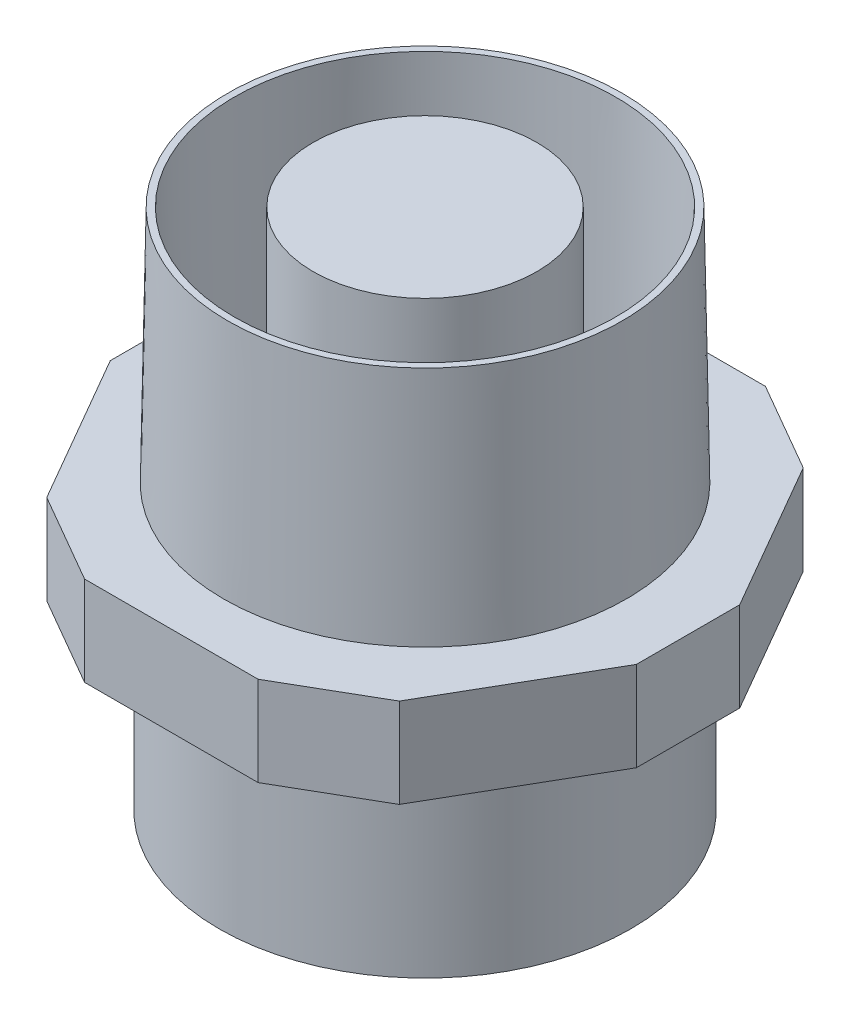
SolidWorks part; units mm, degrees
ref_plane "Plan de face" through (0, 0, 0) normal (0, 0, 1) x (1, 0, 0)
ref_plane "Plan de dessus" through (0, 0, 0) normal (0, 1, 0) x (1, 0, 0)
ref_plane "Plan de droite" through (0, 0, 0) normal (1, 0, 0) x (0, 0, -1)
sketch "Esquisse1" plane through (0, 0, 0) normal (0, 1, 0) x (1, 0, 0)
  line L1 (9.815, 0) -> (4.9075, 8.5)
  line L2 (4.9075, 8.5) -> (-4.9075, 8.5)
  line L3 (-4.9075, 8.5) -> (-9.815, 0)
  line L4 (-9.815, 0) -> (-4.9075, -8.5)
  line L5 (-4.9075, -8.5) -> (4.9075, -8.5)
  line L6 (4.9075, -8.5) -> (9.815, 0)
  circle A0 centre (0, 0) radius 8.5 construction
  dimension "D1" = 17
extrude "Extrusion1" add sketch "Esquisse1" along normal blind 3
sketch "Esquisse2" plane through (0, 3, 0) normal (0, 1, 0) x (1, 0, 0)
  circle A0 centre (0, 0) radius 6.75
  circle A1 centre (0, 0) radius 6.25
  dimension "D1" = 13.5
  dimension "D2" = 0.5
extrude "Extrusion2" add sketch "Esquisse2" along normal blind 8 draft 1
sketch "Esquisse3" plane through (0, 0, 0) normal (0, -1, 0) x (1, 0, 0)
  circle A0 centre (0, 0) radius 6.9
  dimension "D1" = 13.8
extrude "Extrusion3" add sketch "Esquisse3" along normal blind 6.5
chamfer "Chanfrein1" distance 2 distance2 2 6 edges at (4.9075, 1.5, 8.5) (9.815, 1.5, 0) (4.9075, 1.5, -8.5) (-4.9075, 1.5, -8.5) (-4.9075, 1.5, 8.5) (-9.815, 1.5, 0)
sketch "Esquisse4" plane through (0, 3, 0) normal (0, 1, 0) x (1, 0, 0)
  circle A0 centre (0, 0) radius 3.75
  dimension "D1" = 7.5
extrude "Extrusion4" add sketch "Esquisse4" along normal up to surface (8 mm away)
